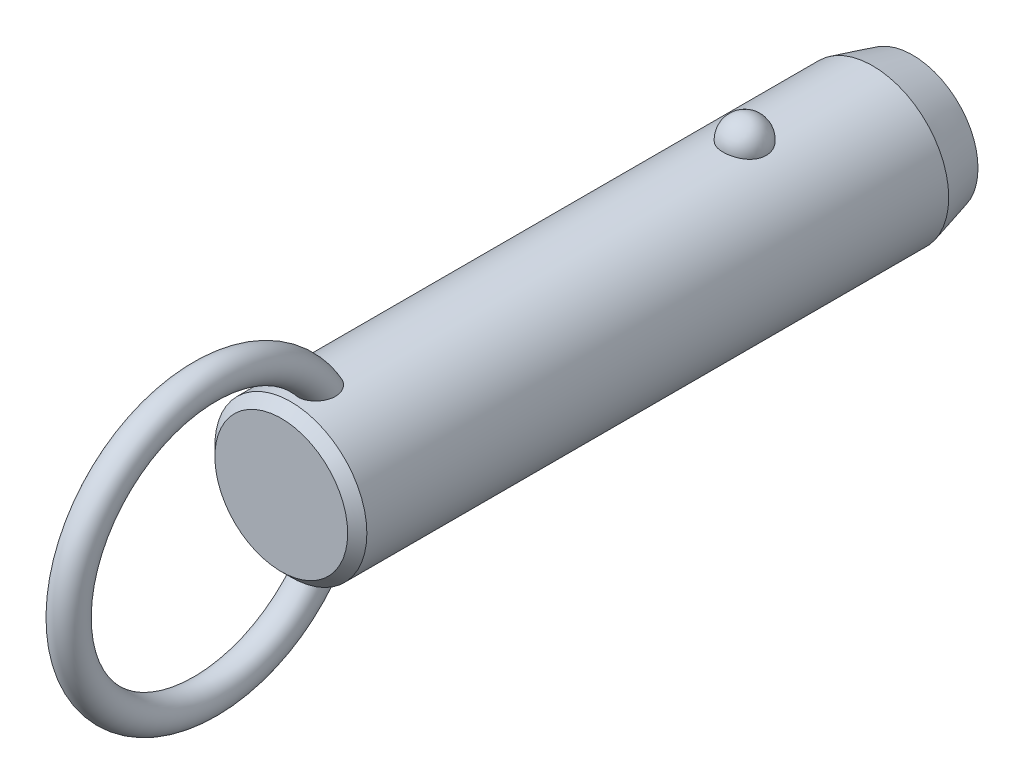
SolidWorks part; units mm, degrees
ref_plane "Front Plane" through (0, 0, 0) normal (0, 0, 1) x (1, 0, 0)
ref_plane "Top Plane" through (0, 0, 0) normal (0, 1, 0) x (1, 0, 0)
ref_plane "Right Plane" through (0, 0, 0) normal (1, 0, 0) x (0, 0, -1)
sketch "Sketch2" plane through (0, 0, 0) normal (0, 0, 1) x (1, 0, 0)
  circle A0 centre (0, 0) radius 9.5
  point P3 (0, 9.5)
  dimension "D1" = 19
extrude "Boss-Extrude1" add sketch "Sketch2" along normal blind 45.7
sketch "Sketch3" plane through (0, 0, 0) normal (0, 0, -1) x (-1, 0, 0)
  circle A0 centre (0, 0) radius 9.5
  dimension "D1" = 19
extrude "Boss-Extrude2" add sketch "Sketch3" along normal blind 23.7
chamfer "Chamfer1" distance 5 angle 15 1 edges at (-9.5, 0, -23.7)
sketch "Sketch12" plane through (0, 0, 0) normal (1, 0, 0) x (0, 0, -1)
  line L0 (-45.7, 9.5) -> (-45.7, -9.5) construction
  point P0 (-45.7, 0)
sketch "Sketch13" plane through (0, 0, 0) normal (1, 0, 0) x (0, 0, -1)
  circle A0 centre (-64.75, 0) radius 19.05
  point P2 (-45.7, 0)
  dimension "D1" = 38.1
sketch "Sketch14" plane through (0, 0, 0) normal (0, 1, 0) x (1, 0, 0)
  circle A0 centre (0, -47.7) radius 2
  point P2 (0, -45.7)
  dimension "D1" = 4
sweep "Sweep1" add profiles "Sketch14" path "Sketch13"
sketch "Sketch15" plane through (0, 0, 45.7) normal (0, 0, 1) x (1, 0, 0)
  circle A0 centre (0, 0) radius 9.5
  dimension "D1" = 19
extrude "Boss-Extrude3" add sketch "Sketch15" along normal blind 9.52
chamfer "Chamfer2" distance 1.2 angle 45 1 edges at (9.5, 0, 55.22)
sketch "Sketch18" plane through (0, 0, 0) normal (1, 0, 0) x (0, 0, -1)
  line L0 (18.7, 9.5) -> (-48.2378, 9.5) construction
  line L1 (2.7, 12.2) -> (2.7, 6.8)
  line L2 (-48.2378, -9.5) -> (18.7, -9.5) construction
  arc A0 (2.7, 12.2) -> (2.7, 6.8) centre (2.7, 9.5) ccw
  point P4 (0, 9.5)
  dimension "D1" = 21.7
revolve "Revolve1" add sketch "Sketch18" angle 360 about L1
